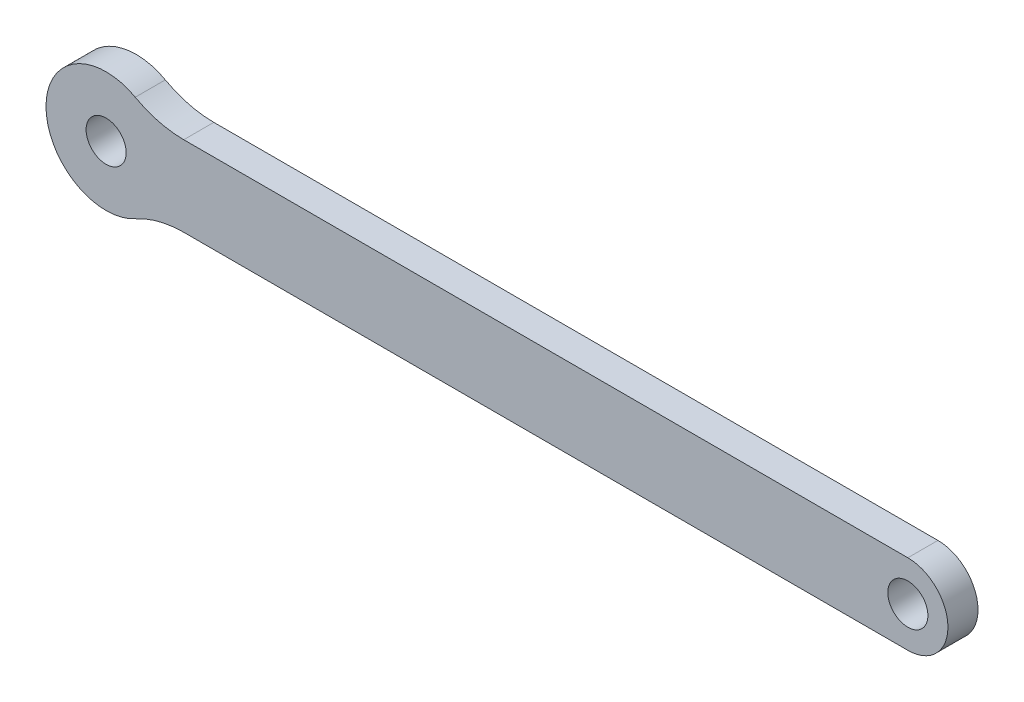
SolidWorks part; units mm, degrees
ref_plane "Front Plane" through (0, 0, 0) normal (0, 0, 1) x (1, 0, 0)
ref_plane "Top Plane" through (0, 0, 0) normal (0, 1, 0) x (1, 0, 0)
ref_plane "Right Plane" through (0, 0, 0) normal (1, 0, 0) x (0, 0, -1)
imported_body "Imported1"
sketch "Sketch1" plane through (0, 0, 3) normal (0, 0, 1) x (1, 0, 0)
  circle A0 centre (118.6471, 61.5642) radius 2
  circle A1 centre (198.6471, 61.5642) radius 2
extrude "Cut-Extrude1" cut sketch "Sketch1" against normal blind 3
